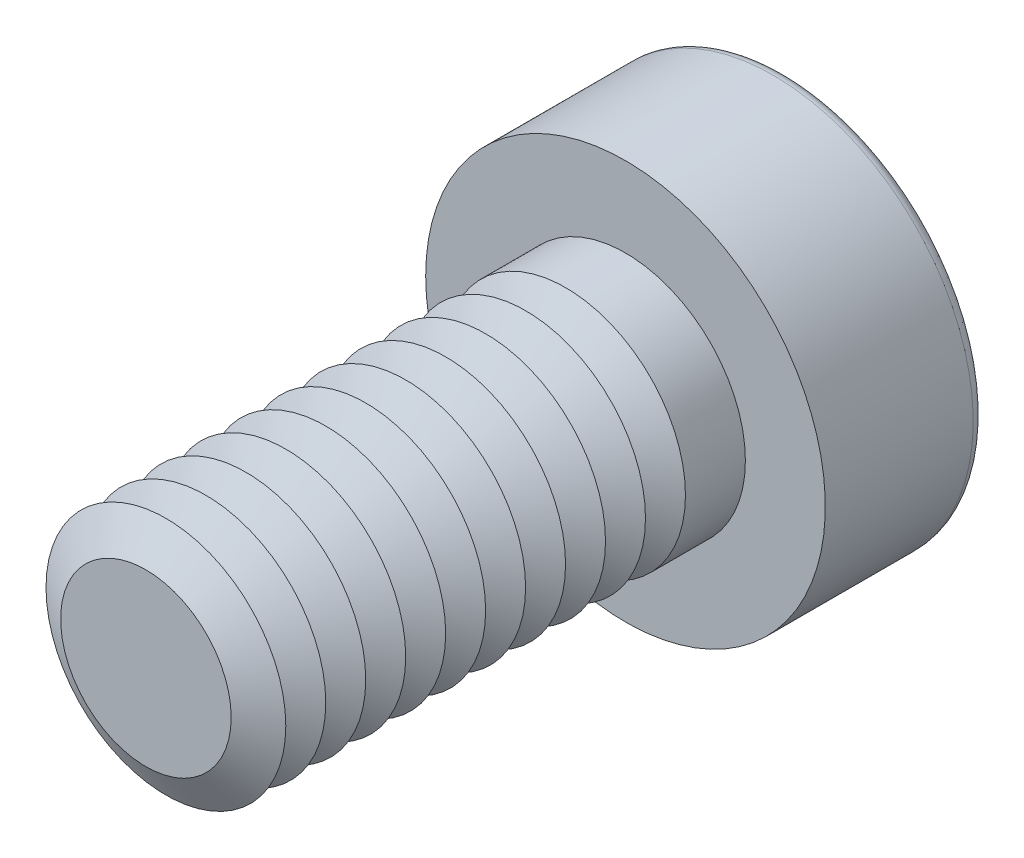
SolidWorks part; units mm, degrees
ref_plane "Front Plane" through (0, 0, 0) normal (0, 0, 1) x (1, 0, 0)
ref_plane "Top Plane" through (0, 0, 0) normal (0, 1, 0) x (1, 0, 0)
ref_plane "Right Plane" through (0, 0, 0) normal (1, 0, 0) x (0, 0, -1)
sketch "Sketch1" plane through (0, 0, 0) normal (0, 0, 1) x (1, 0, 0)
  circle A0 centre (0, 0) radius 3
  dimension "D1" = 6
extrude "Boss-Extrude1" add sketch "Sketch1" along normal blind 12
sketch "Sketch2" plane through (0, 0, 0) normal (0, 0, -1) x (-1, 0, 0)
  circle A0 centre (0, 0) radius 5
  dimension "D1" = 10
extrude "Boss-Extrude2" add sketch "Sketch2" along normal blind 4
sketch "Sketch3" plane through (0, 0, -4) normal (0, 0, -1) x (-1, 0, 0)
  line L1 (-1.1547, 2) -> (-2.3094, 0)
  line L2 (-2.3094, 0) -> (-1.1547, -2)
  line L3 (-1.1547, -2) -> (1.1547, -2)
  line L4 (1.1547, -2) -> (2.3094, 0)
  line L5 (2.3094, 0) -> (1.1547, 2)
  line L6 (1.1547, 2) -> (-1.1547, 2)
  circle A0 centre (0, 0) radius 2 construction
  dimension "D1" = 4
extrude "Cut-Extrude1" cut sketch "Sketch3" against normal blind 3
fillet "Fillet1" radius 0.3 1 edges at (-5, 0, -4)
sketch "Sketch4" plane through (0, 0, -1) normal (0, 0, -1) x (-1, 0, 0)
  line L0 (1.1547, -2) -> (2.3094, 0) construction
  circle A0 centre (0, 0) radius 2
extrude "Cut-Extrude2" cut sketch "Sketch4" against normal through all draft 60
sketch "Sketch5" plane through (0, 0, -4) normal (0, 0, -1) x (-1, 0, 0)
  circle A0 centre (0, 0) radius 2.3094
extrude "Cut-Extrude3" cut sketch "Sketch5" against normal through all draft 75
sketch "Sketch7" plane through (0, 0, 0) normal (1, 0, 0) x (0, 0, -1)
  line L25 (-12, 2.134) -> (-11.5, 3)
  line L26 (-12, 3) -> (-12, -3) construction
  line L27 (-11.5, 3) -> (-12.5, 3)
  line L28 (-12.5, 3) -> (-12, 2.134)
  line L29 (0, 3) -> (-12, 3) construction
  dimension "D1" = 1
revolve "Cut-Revolve1" cut sketch "Sketch7" angle 360 about axis through (0, 0, 12) along (0, 0, -1)
pattern_linear "LPattern1" count 11 spacing 1 along (0, 0, -1) of "Cut-Revolve1"
